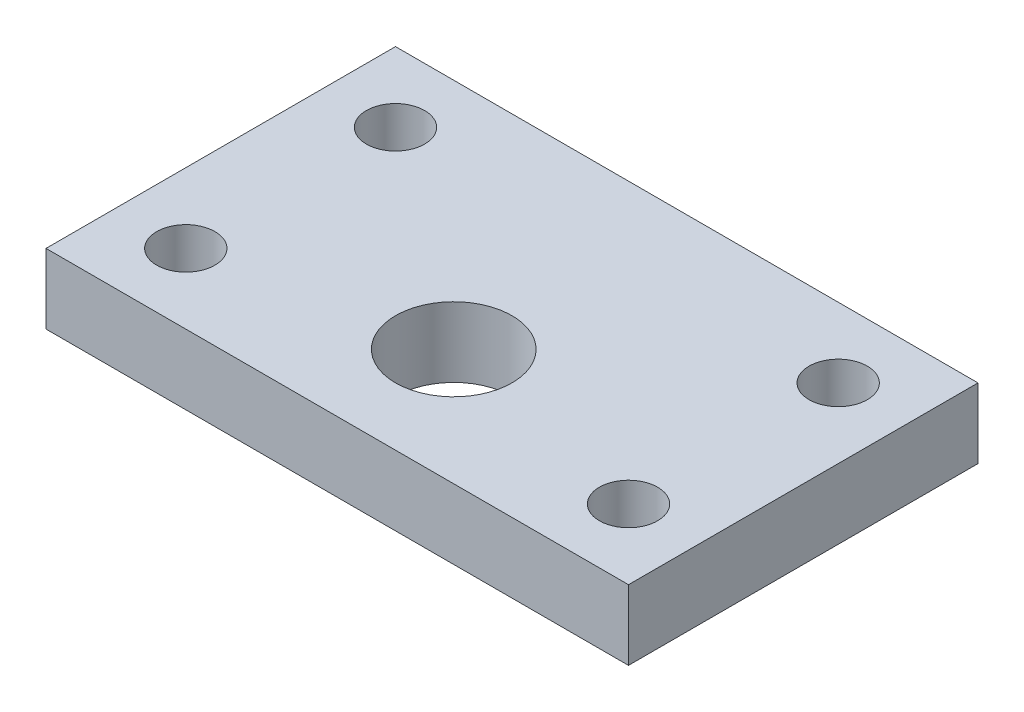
SolidWorks part; units mm, degrees
ref_plane "Front Plane" through (0, 0, 0) normal (0, 0, 1) x (1, 0, 0)
ref_plane "Top Plane" through (0, 0, 0) normal (0, 1, 0) x (1, 0, 0)
ref_plane "Right Plane" through (0, 0, 0) normal (1, 0, 0) x (0, 0, -1)
sketch "Sketch1" plane through (0, 0, 0) normal (0, 1, 0) x (1, 0, 0)
  line L1 (0, 0) -> (250, 0)
  line L2 (0, 0) -> (0, 150)
  line L3 (0, 150) -> (250, 150)
  line L4 (250, 0) -> (250, 150)
  dimension "D1" = 150
  dimension "D2" = 250
extrude "Boss-Extrude1" add sketch "Sketch1" along normal blind 30
sketch "Sketch2" plane through (0, 30, 0) normal (0, 1, 0) x (1, 0, 0)
  line L0 (0, 0) -> (250, 0) construction
  line L2 (0, 150) -> (0, 0) construction
  circle A0 centre (30, 120) radius 12.5
  circle A1 centre (220, 120) radius 12.5
  circle A2 centre (220, 30) radius 12.5
  circle A3 centre (30, 30) radius 12.5
  circle A4 centre (125, 50) radius 25
  dimension "D1" = 25
  dimension "D6" = 50
  dimension "D2" = 30
  dimension "D3" = 90
  dimension "D4" = 30
  dimension "D5" = 190
  dimension "D7" = 50
  dimension "D8" = 125
extrude "Cut-Extrude1" cut sketch "Sketch2" against normal through all
